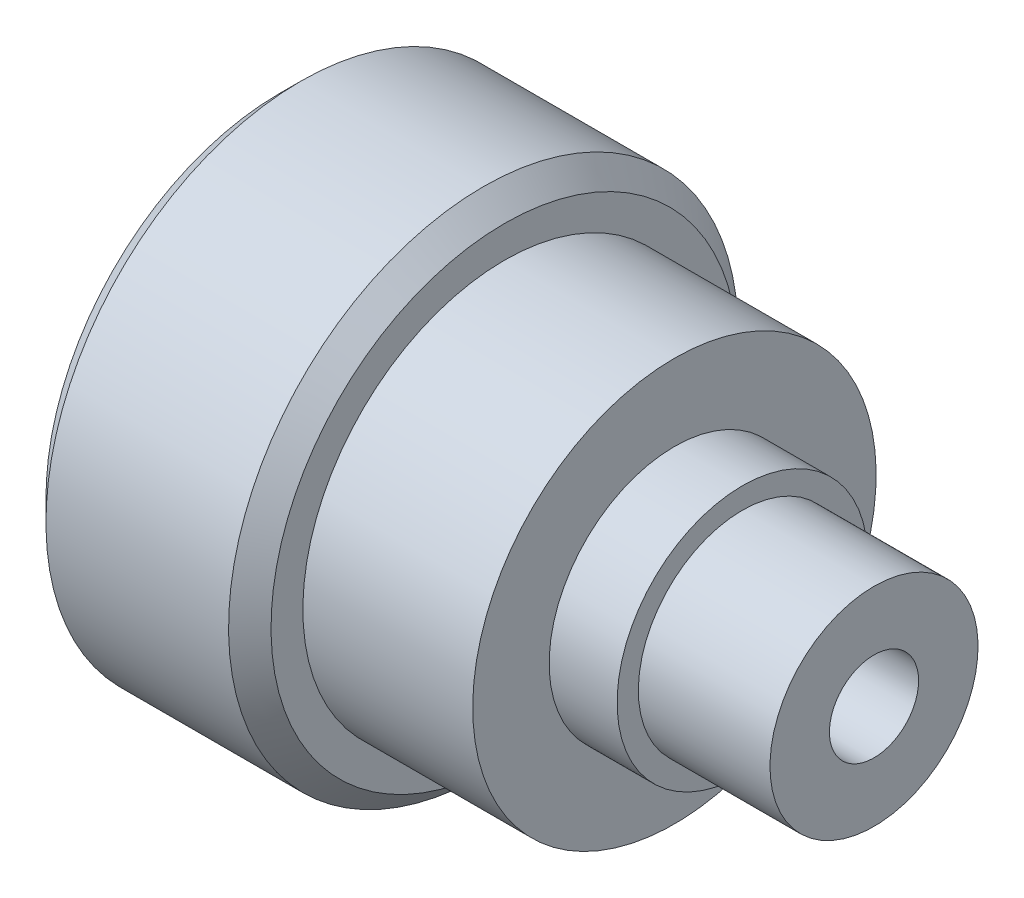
SolidWorks part; units mm, degrees
ref_plane "Front Plane" through (0, 0, 0) normal (0, 0, 1) x (1, 0, 0)
ref_plane "Top Plane" through (0, 0, 0) normal (0, 1, 0) x (1, 0, 0)
ref_plane "Right Plane" through (0, 0, 0) normal (1, 0, 0) x (0, 0, -1)
sketch "Sketch1" plane through (0, 0, 0) normal (0, 0, 1) x (1, 0, 0)
  line L0 (0, 2.5) -> (0, 11)
  line L1 (0, 11) -> (1, 12)
  line L2 (1, 12) -> (9.6, 12)
  line L3 (9.6, 12) -> (10.6, 11)
  line L4 (10.6, 11) -> (10.6, 9.5)
  line L5 (10.6, 9.5) -> (18.6, 9.5)
  line L6 (18.6, 9.5) -> (18.6, 5.9)
  line L7 (18.6, 5.9) -> (21.8, 5.9)
  line L8 (21.8, 5.9) -> (21.8, 4.9)
  line L9 (21.8, 4.9) -> (28, 4.9)
  line L10 (28, 4.9) -> (28, 0)
  line L11 (28, 0) -> (18.6, 0)
  line L12 (0, 2.5) -> (18.6, 2.5)
  line L13 (18.6, 2.5) -> (18.6, 0)
  dimension "D1" = 12
  dimension "D2" = 1
  dimension "D3" = 1
  dimension "D4" = 1
  dimension "D5" = 1
  dimension "D6" = 4.9
  dimension "D7" = 5.9
  dimension "D8" = 9.5
  dimension "D9" = 6.2
  dimension "D10" = 3.2
  dimension "D11" = 8
  dimension "D12" = 28
  dimension "D13" = 2.5
revolve "Revolve1" add sketch "Sketch1" angle 360 about L11
hole_wizard "M5 Tapped Hole1" positions "3DSketch2" profile "Sketch3" tap size "M5" standard "ISO"
sketch3d "3DSketch2"
  line L0 (21.8, 0, 0) -> (28, 0, 0) construction
  point P0 (28, 0, 0)
sketch "Sketch3" plane through (28, 0, 0) normal (0, 1, 0) x (0, 0, -1)
  line L0 (0, 0) -> (0, 10.6618)
  line L1 (0, 10.6618) -> (2.1, 9.4)
  line L2 (2.1, 9.4) -> (2.1, 0)
  line L5 (2.1, 0) -> (0, 0)
  line L10 (0, 10.6618) -> (-2.1, 9.4) construction
  line L11 (0, -6.35) -> (0, 107.95) construction
  dimension "Tap Drill Dia." = 4.2
  dimension "Tap Drill Depth" = 9.4
  dimension "Drill Angle" = 118
